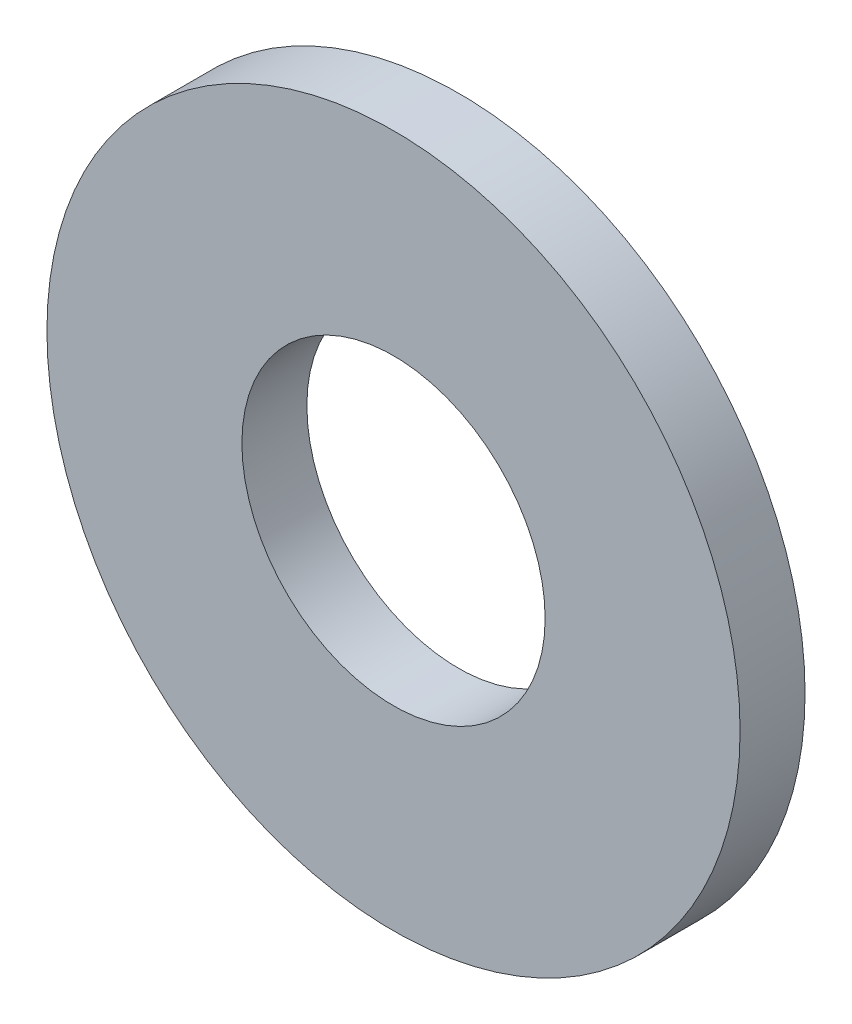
SolidWorks part; units mm, degrees
ref_plane "Plane1" through (0, 0, 0) normal (0, 0, 1) x (1, 0, 0)
ref_plane "Plane2" through (0, 0, 0) normal (0, 1, 0) x (1, 0, 0)
ref_plane "Plane3" through (0, 0, 0) normal (1, 0, 0) x (0, 0, -1)
sketch "Sketch1" plane through (0, 0, 0) normal (0, 0, 1) x (1, 0, 0)
  circle A0 centre (0, 0) radius 6.35
  circle A1 centre (0, 0) radius 2.7781
  dimension "O.D." = 12.7
  dimension "I.D." = 5.5562
extrude "Washer" add sketch "Sketch1" along normal blind 1.1906
